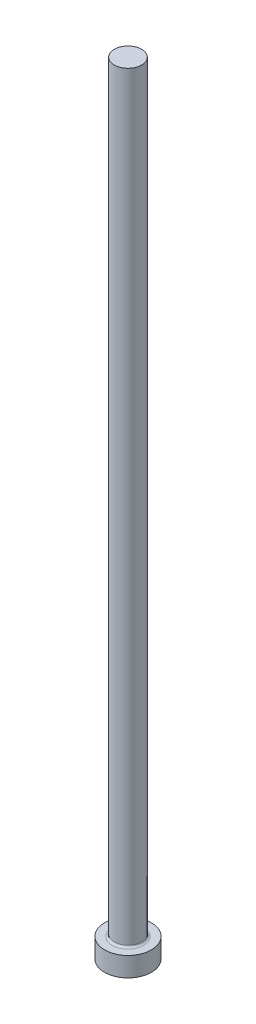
SolidWorks part; units mm, degrees
ref_plane "Plano frontal" through (0, 0, 0) normal (0, 0, 1) x (1, 0, 0)
ref_plane "Plano superior" through (0, 0, 0) normal (0, 1, 0) x (1, 0, 0)
ref_plane "Plano direito" through (0, 0, 0) normal (1, 0, 0) x (0, 0, -1)
sketch "Esboço1" plane through (0, 0, 0) normal (0, 0, 1) x (1, 0, 0)
  line L0 (0, 0) -> (6, 0)
  line L1 (6, 0) -> (6, 5)
  line L2 (6, 5) -> (4, 5)
  line L3 (3.5, 5.5) -> (3.5, 200)
  line L4 (3.5, 200) -> (0, 200)
  line L5 (0, 200) -> (0, 0) construction
  line L6 (0, 0) -> (0, 200)
  arc A0 (4, 5) -> (3.5, 5.5) centre (4, 5.5) cw
  dimension "D3" = 0.5
  dimension "D1" = 12
  dimension "D2" = 7
  dimension "D4" = 5
  dimension "D5" = 200
revolve "Revolução1" add sketch "Esboço1" angle 360 about L5
sketch "Esboço2"
  dimension "D1" = 1.05
  dimension "D2" = 0.675
  dimension "D3" = 3.225
  dimension "D4" = 0.45
wrap "Envolver1" sketch "Esboço2" wrap type deboss source sketch "Esboço2" thickness 0.1 parameters "D1"=0.1
